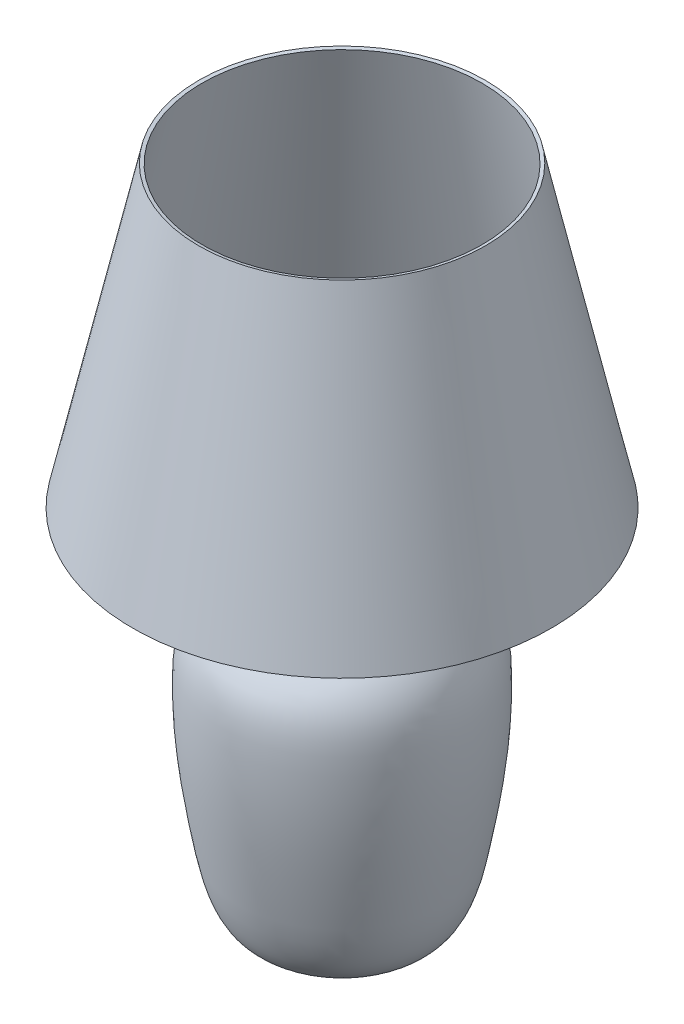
SolidWorks part; units mm, degrees
ref_plane "Płaszczyzna przednia" through (0, 0, 0) normal (0, 0, 1) x (1, 0, 0)
ref_plane "Płaszczyzna górna" through (0, 0, 0) normal (0, 1, 0) x (1, 0, 0)
ref_plane "Płaszczyzna prawa" through (0, 0, 0) normal (1, 0, 0) x (0, 0, -1)
sketch "Szkic1" plane through (0, 0, 0) normal (0, 0, 1) x (1, 0, 0)
  line L0 (268.3015, 536.603) -> (1341.5074, 536.603) construction
  line L1 (833.0448, 188.8399) -> (883.8003, 188.8399)
  line L2 (863.4434, 470.5104) -> (830.4434, 470.5104)
  line L3 (830.4434, 470.5104) -> (830.4434, 500.5104)
  line L4 (830.4434, 500.5104) -> (1005.4434, 500.5104)
  line L5 (1005.4434, 500.5104) -> (947.9434, 760.5104)
  line L6 (833.0448, 188.8399) -> (822.9434, 188.8399)
  line L7 (822.9434, 188.8399) -> (822.9434, 511.7325) construction
  spline S0 degree 3 poles (883.8003, 188.8399) (894.9413, 193.8915) (908.1852, 216.6721) (917.836, 266.1981) (926.3111, 319.4393) (928.148, 370.4515) (925.4016, 420.3256) (897.3778, 446.2365) (864.5937, 457.0827) (863.7624, 462.8441) (863.4434, 470.5104) knots 0 0 0 0 0.107798 0.240005 0.475023 0.614108 0.72592 0.928993 0.956401 1 1 1 1
  dimension "D1" = 100
  dimension "D2" = 33
  dimension "D3" = 15
  dimension "D4" = 281.6705
  dimension "D5" = 30
  dimension "D6" = 175
  dimension "D7" = 125
  dimension "D8" = 260
revolve "Obrót-cienka ścianka2" add sketch "Szkic1" angle 360 about L7
